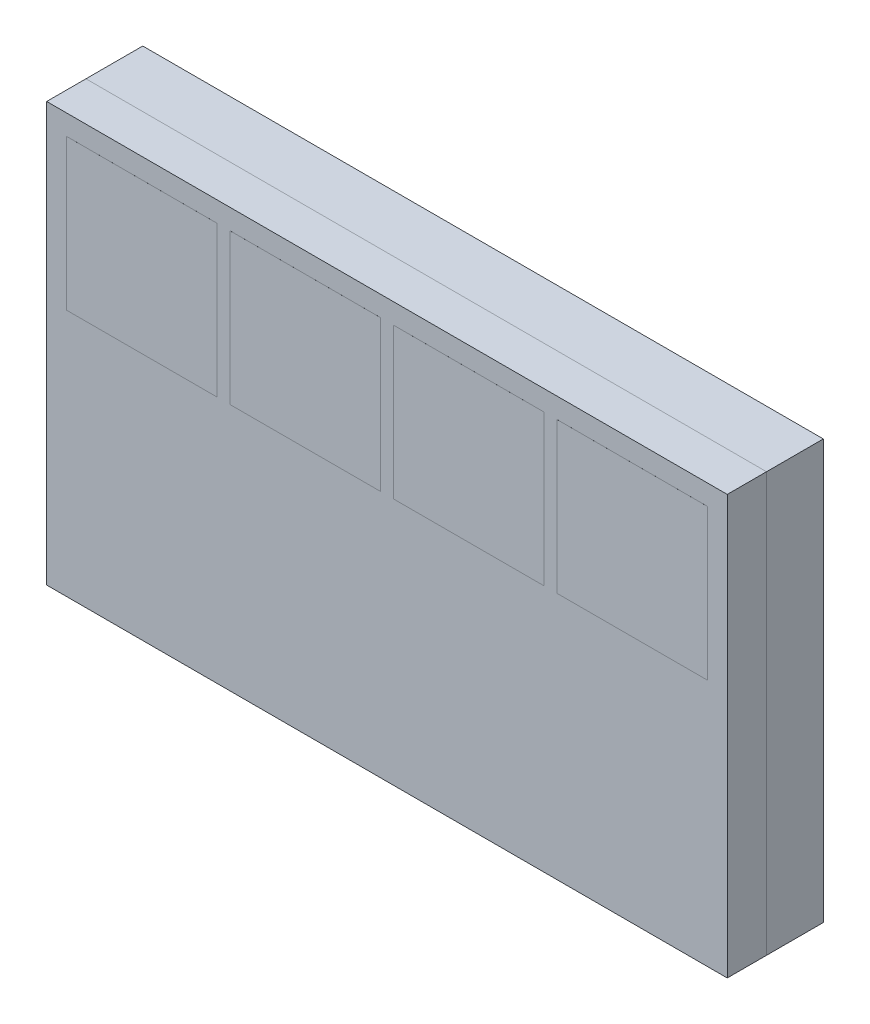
SolidWorks part; units mm, degrees
ref_plane "前视基准面" through (0, 0, 0) normal (0, 0, 1) x (1, 0, 0)
ref_plane "上视基准面" through (0, 0, 0) normal (0, 1, 0) x (1, 0, 0)
ref_plane "右视基准面" through (0, 0, 0) normal (1, 0, 0) x (0, 0, -1)
sketch "草图1" plane through (0, 0, 0) normal (0, 0, 1) x (1, 0, 0)
  line L1 (-2.6, 0.73) -> (2.6, 0.73)
  line L2 (-2.6, 0.73) -> (-2.6, -2.47)
  line L3 (-2.6, -2.47) -> (2.6, -2.47)
  line L4 (2.6, 0.73) -> (2.6, -2.47)
  line L5 (-2.6, 0.73) -> (2.6, -2.47) construction
  line L6 (-2.6, -2.47) -> (2.6, 0.73) construction
  point P0 (0, -0.87)
  point P5 (0, 1.3357)
  point P6 (0, 1.3357)
  dimension "D1" = 3.2
  dimension "D2" = 5.2
  dimension "D3" = 0
  dimension "D4" = 0.87
extrude "凸台-拉伸1" add sketch "草图1" against normal blind 0.3 contours L1 L4 L3 L2
sketch "草图2" plane through (0, 0, 0) normal (0, 0, 1) x (1, 0, 0)
  line L0 (-2.6, 0.73) -> (2.6, 0.73) construction
  line L1 (-2.45, 0.575) -> (-1.3, 0.575)
  line L2 (-2.45, 0.575) -> (-2.45, -0.575)
  line L3 (-2.45, -0.575) -> (-1.3, -0.575)
  line L4 (-1.3, 0.575) -> (-1.3, -0.575)
  line L5 (-2.45, 0.575) -> (-1.3, -0.575) construction
  line L6 (-2.45, -0.575) -> (-1.3, 0.575) construction
  line L7 (-2.6, 0.73) -> (-2.6, -2.47) construction
  line L8 (-1.2, 0.575) -> (-1.2, -0.575)
  line L9 (-1.2, 0.575) -> (-0.05, 0.575)
  line L10 (-0.05, 0.575) -> (-0.05, -0.575)
  line L11 (-1.2, -0.575) -> (-0.05, -0.575)
  line L12 (0.05, 0.575) -> (0.05, -0.575)
  line L13 (0.05, 0.575) -> (1.2, 0.575)
  line L14 (1.2, 0.575) -> (1.2, -0.575)
  line L15 (0.05, -0.575) -> (1.2, -0.575)
  line L16 (1.3, 0.575) -> (1.3, -0.575)
  line L17 (1.3, 0.575) -> (2.45, 0.575)
  line L18 (2.45, 0.575) -> (2.45, -0.575)
  line L19 (1.3, -0.575) -> (2.45, -0.575)
  point P0 (-1.875, 0)
  dimension "D1" = 1.15
  dimension "D2" = 1.15
  dimension "D3" = 0.155
  dimension "D4" = 0.15
  dimension "D5" = 4
extrude "凸台-拉伸2" add sketch "草图2" along normal blind 0.0001
sketch "草图3" plane through (0, 0, -0.3) normal (0, 0, -1) x (-1, 0, 0)
  line L4 (2.6, -2.47) -> (2.6, 0.73)
  line L5 (2.6, 0.73) -> (-2.6, 0.73)
  line L6 (-2.6, 0.73) -> (-2.6, -2.47)
  line L7 (-2.6, -2.47) -> (2.6, -2.47)
  line L8 (2.6, -2.47) -> (2.6, 0.73)
  line L9 (2.6, 0.73) -> (-2.6, 0.73)
  line L10 (-2.6, 0.73) -> (-2.6, -2.47)
  line L11 (-2.6, -2.47) -> (2.6, -2.47)
  dimension "D1" = 0
extrude "凸台-拉伸3" add sketch "草图3" along normal blind 0.434 separate body
sketch "草图4" plane through (0, 0, -0.734) normal (0, 0, -1) x (-1, 0, 0)
  line L0 (-2.6, 0.73) -> (-2.6, -2.47) construction
  line L1 (-1.9, 0.55) -> (-0.5, 0.55)
  line L2 (-2.2, 0.25) -> (-2.2, -0.37)
  line L3 (-1.9, -0.67) -> (-0.5, -0.67)
  line L4 (-0.2, 0.25) -> (-0.2, -0.37)
  line L5 (-2.2, 0.55) -> (-0.2, -0.67) construction
  line L6 (-2.2, -0.67) -> (-0.2, 0.55) construction
  line L7 (2.6, 0.73) -> (-2.6, 0.73) construction
  line L8 (0.2, 0.25) -> (0.2, -0.37)
  line L9 (0.5, 0.55) -> (1.9, 0.55)
  line L10 (2.2, 0.25) -> (2.2, -0.37)
  line L11 (0.5, -0.67) -> (1.9, -0.67)
  line L12 (0.2, -1.47) -> (0.2, -1.99)
  line L13 (0.6, -1.07) -> (1.9, -1.07)
  line L14 (2.2, -1.37) -> (2.2, -1.99)
  line L15 (0.5, -2.29) -> (1.9, -2.29)
  line L16 (-2.2, -1.37) -> (-2.2, -1.99)
  line L17 (-1.9, -1.07) -> (-0.5, -1.07)
  line L18 (-0.2, -1.37) -> (-0.2, -1.99)
  line L19 (-1.9, -2.29) -> (-0.5, -2.29)
  line L22 (-2.6, -2.47) -> (2.6, -2.47) construction
  line L23 (2.6, -2.47) -> (2.6, 0.73) construction
  line L24 (0.2, -1.47) -> (0.6, -1.07)
  arc A0 (-1.9, -1.07) -> (-2.2, -1.37) centre (-1.9, -1.37) ccw
  arc A1 (-2.2, -1.99) -> (-1.9, -2.29) centre (-1.9, -1.99) ccw
  arc A2 (-0.5, -2.29) -> (-0.2, -1.99) centre (-0.5, -1.99) ccw
  arc A3 (-0.2, -1.37) -> (-0.5, -1.07) centre (-0.5, -1.37) ccw
  arc A5 (0.2, -1.99) -> (0.5, -2.29) centre (0.5, -1.99) ccw
  arc A6 (1.9, -2.29) -> (2.2, -1.99) centre (1.9, -1.99) ccw
  arc A7 (2.2, -1.37) -> (1.9, -1.07) centre (1.9, -1.37) ccw
  arc A8 (1.9, -0.67) -> (2.2, -0.37) centre (1.9, -0.37) ccw
  arc A9 (1.9, 0.55) -> (2.2, 0.25) centre (1.9, 0.25) cw
  arc A10 (0.2, 0.25) -> (0.5, 0.55) centre (0.5, 0.25) cw
  arc A11 (0.2, -0.37) -> (0.5, -0.67) centre (0.5, -0.37) ccw
  arc A12 (-0.5, -0.67) -> (-0.2, -0.37) centre (-0.5, -0.37) ccw
  arc A13 (-0.2, 0.25) -> (-0.5, 0.55) centre (-0.5, 0.25) ccw
  arc A14 (-1.9, -0.67) -> (-2.2, -0.37) centre (-1.9, -0.37) cw
  arc A15 (-2.2, 0.25) -> (-1.9, 0.55) centre (-1.9, 0.25) cw
  point P0 (-1.2, -0.06)
  dimension "D7" = 0.3
  dimension "D1" = 2
  dimension "D2" = 1.22
  dimension "D3" = 0.4
  dimension "D4" = 0.18
  dimension "D9" = 0.18
  dimension "D11" = 0.4
  dimension "D5" = 2
  dimension "D6" = 2
extrude "凸台-拉伸4" add sketch "草图4" along normal blind 0.056
